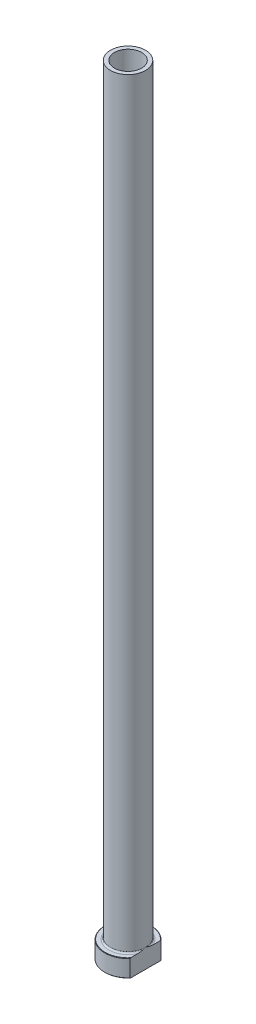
SolidWorks part; units mm, degrees
ref_plane "Front Plane" through (0, 0, 0) normal (0, 0, 1) x (1, 0, 0)
ref_plane "Top Plane" through (0, 0, 0) normal (0, 1, 0) x (1, 0, 0)
ref_plane "Right Plane" through (0, 0, 0) normal (1, 0, 0) x (0, 0, -1)
sketch "Sketch1" plane through (0, 0, 0) normal (0, 0, 1) x (1, 0, 0)
  line L0 (-7, 400) -> (-9, 400)
  line L1 (-9, 400) -> (-9, 9)
  line L2 (-9, 9) -> (-12, 9)
  line L3 (-12, 9) -> (-12, 0)
  line L4 (11.55, 0) -> (-11.55, 0) construction
  line L5 (-12, 0) -> (-7.25, 0)
  line L6 (-7, 345) -> (-7, 400)
  line L7 (0, 92.1877) -> (0, -15.5353) construction
  line L8 (0, -13.2) -> (0, 13.2) construction
  line L9 (-7, 345) -> (-7.25, 333)
  line L10 (-7.25, 333) -> (-7.25, 0)
  dimension "D1" = 0.25
  dimension "ID" = 14
  dimension "OD" = 18
  dimension "L" = 400
  dimension "H" = 24
  dimension "T" = 9
  dimension "N" = 55
  dimension "D2" = 12
  dimension "L-N" = 345
revolve "Revolve1" add sketch "Sketch1" angle 360 about L7
fillet "Fillet1" radius 0.8 1 edges at (0, 9, 9)
chamfer "Chamfer1" distance 0.2 angle 45 2 edges at (0, 9, 12) (0, 0, 12)
sketch "Sketch2" plane through (0, 0, 0) normal (0, -1, 0) x (1, 0, 0)
  line L0 (9, 7.9373) -> (9, -7.9373)
  circle A0 centre (0, 0) radius 12 construction
  arc A1 (9, 7.9373) -> (9, -7.9373) centre (0, 0) cw
  circle A2 centre (0, 0) radius 9 construction
extrude "Cut-Extrude1" cut sketch "Sketch2" against normal through all
chamfer "Chamfer2" distance 0.5 angle 45 1 edges at (0, 0, 7.25)
